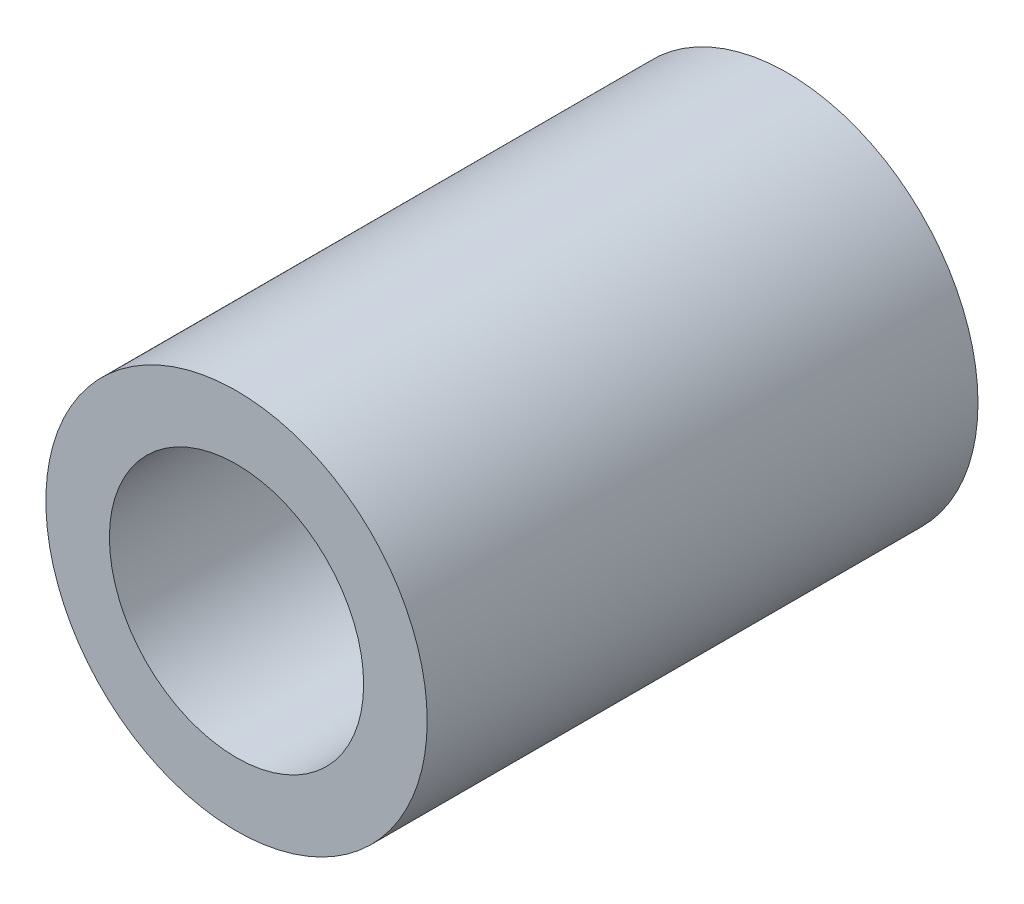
SolidWorks part; units mm, degrees
ref_plane "前视基准面" through (0, 0, 0) normal (0, 0, 1) x (1, 0, 0)
ref_plane "上视基准面" through (0, 0, 0) normal (0, 1, 0) x (1, 0, 0)
ref_plane "右视基准面" through (0, 0, 0) normal (1, 0, 0) x (0, 0, -1)
sketch "草图1" plane through (0, 0, 0) normal (0, 0, 1) x (1, 0, 0)
  circle A0 centre (0, 0) radius 22.5
  circle A1 centre (0, 0) radius 15
  dimension "D1" = 45
  dimension "D2" = 30
extrude "拉伸1" add sketch "草图1" along normal mid plane 65
sketch "草图2" plane through (0, 0, 0) normal (0, 1, 0) x (1, 0, 0)
  circle A0 centre (0, 0) radius 4
  dimension "D1" = 8
extrude "切除-拉伸1" cut sketch "草图2" against normal blind 60
